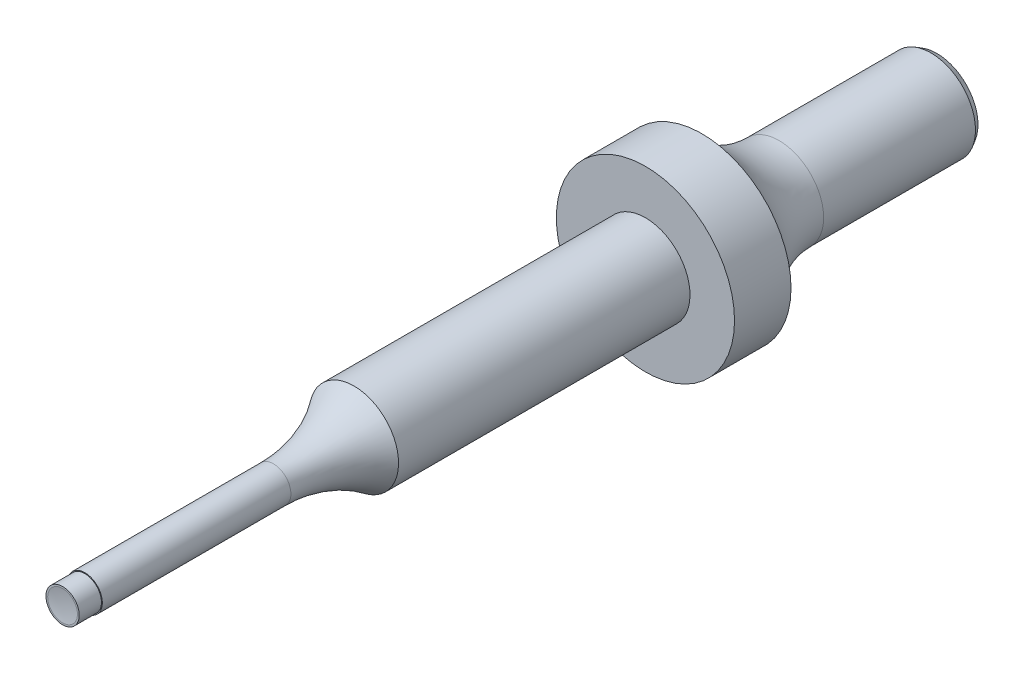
SolidWorks part; units mm, degrees
ref_plane "Front Plane" through (0, 0, 0) normal (0, 0, 1) x (1, 0, 0)
ref_plane "Top Plane" through (0, 0, 0) normal (0, 1, 0) x (1, 0, 0)
ref_plane "Right Plane" through (0, 0, 0) normal (1, 0, 0) x (0, 0, -1)
sketch "Sketch1" plane through (0, 0, 0) normal (0, 0, 1) x (1, 0, 0)
  circle A0 centre (0, 0) radius 5.095
  dimension "D1" = 10.19
extrude "Boss-Extrude1" add sketch "Sketch1" against normal blind 100
sketch "Sketch2" plane through (0, 0, 0) normal (0, 0, 1) x (1, 0, 0)
  circle A0 centre (0, 0) radius 2
  dimension "D1" = 4
extrude "Cut-Extrude1" cut sketch "Sketch2" against normal blind 33.3333 flip side to cut
sketch "Sketch3" plane through (0, 0, 0) normal (0, 0, 1) x (1, 0, 0)
  circle A0 centre (0, 0) radius 1.9
  dimension "D1" = 3.8
extrude "Cut-Extrude2" cut sketch "Sketch3" against normal blind 2.5475 flip side to cut
sketch "Sketch4" plane through (0, 0, 0) normal (1, 0, 0) x (0, 0, -1)
  line L0 (0, 0) -> (0, 1.7)
  line L1 (0, 1.9) -> (0, -1.9) construction
  line L2 (0.1428, 0) -> (0.1428, 1.7) construction
  line L3 (0, 0) -> (0.1428, 0)
  line L4 (0, 0) -> (0, -1.7) construction
  arc A0 (0.1428, 0) -> (0, 1.7) centre (-10.0472, 0) ccw
  dimension "D2" = 10.19
  dimension "D1" = 3.4
revolve "Cut-Revolve1" cut sketch "Sketch4" angle 360 about L3
chamfer "Chamfer1" distance 0.6793 angle 30 1 edges at (5.095, 0, -100)
sketch "Sketch5" plane through (0, 0, 0) normal (1, 0, 0) x (0, 0, -1)
  line L0 (33.3333, 0) -> (24.1119, 0)
  line L1 (33.3333, 5.095) -> (33.3333, -5.095) construction
  line L2 (24.1119, 0) -> (24.1119, 2)
  line L3 (33.3333, 2) -> (2.5475, 2) construction
  line L4 (33.3333, 5.095) -> (33.3333, 0)
  line L5 (24.1119, 2) -> (33.3333, 2) construction
  arc A0 (24.1119, 2) -> (33.3333, 5.095) centre (24.1119, 17.285) ccw
  dimension "D1" = 15.285
revolve "Revolve1" add sketch "Sketch5" angle 360 about L0
sketch "Sketch6" plane through (0, 0, 0) normal (1, 0, 0) x (0, 0, -1)
  line L0 (66.6667, 0) -> (81.9517, 0)
  line L1 (66.6667, 0) -> (66.6667, 10.19)
  line L2 (66.6667, 10.19) -> (73.1269, 10.19)
  line L3 (81.9517, 0) -> (81.9517, 5.095)
  line L4 (99.3207, 5.095) -> (33.3333, 5.095) construction
  line L5 (81.9517, 5.095) -> (66.6667, 5.095) construction
  line L6 (100, -5.095) -> (100, 5.095) construction
  arc A0 (81.9517, 5.095) -> (73.1269, 10.19) centre (81.9517, 15.285) cw
  dimension "D2" = 10.19
  dimension "D1" = 33.3333
  dimension "D3" = 15.285
revolve "Revolve2" add sketch "Sketch6" angle 360 about L0
sketch "Sketch7" plane through (0, 0, -100) normal (0, 0, -1) x (-1, 0, 0)
  line L9 (-8.6234, 1.9603) -> (-4.7028, 1.9603)
  line L10 (-8.6234, 1.9603) -> (-8.6234, -1.9603)
  line L11 (-8.6234, -1.9603) -> (-4.7028, -1.9603)
  line L12 (-4.7028, 1.9603) -> (-4.7028, -1.9603)
  circle A5 centre (0, 0) radius 5.095 construction
  circle A6 centre (0, 0) radius 4.7028 construction
  point P8 (-4.7028, 0)
extrude "Cut-Extrude3" [suppressed] cut sketch "Sketch7" against normal through all
